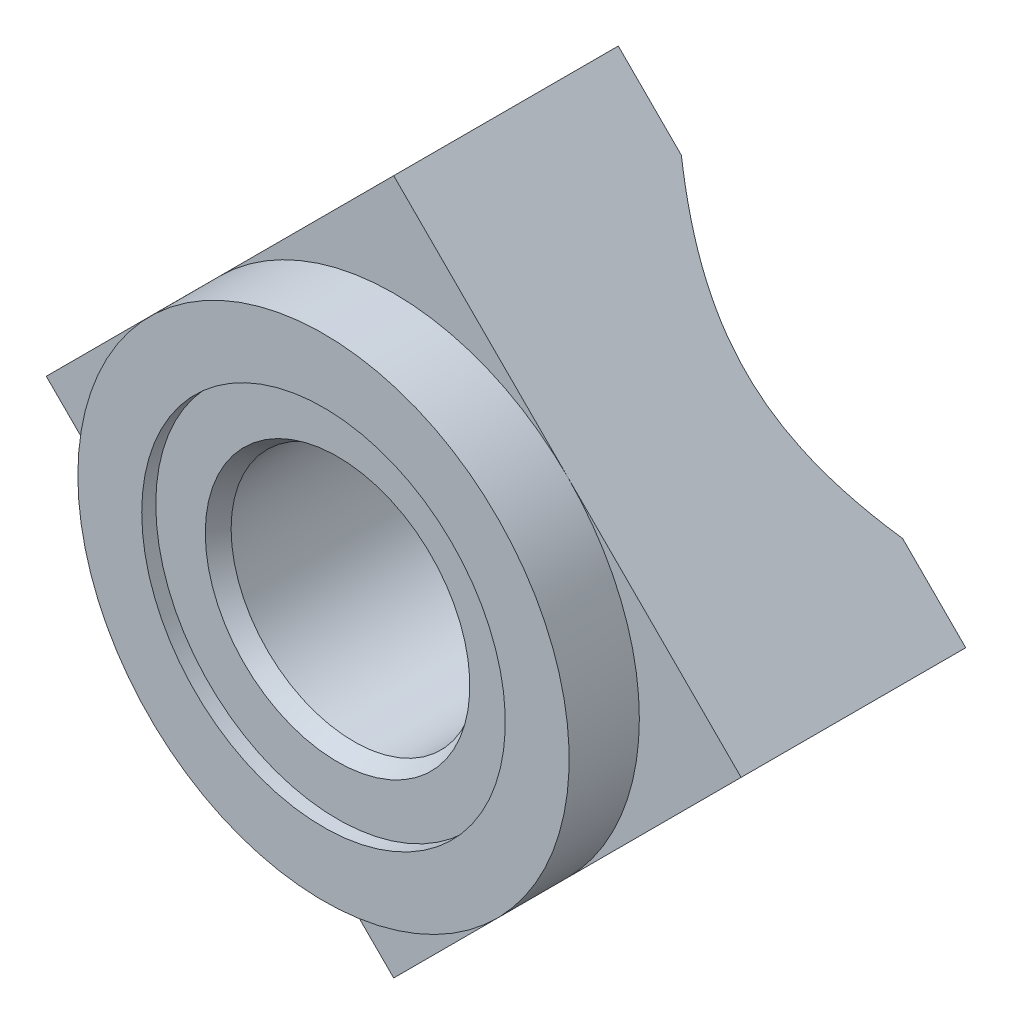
SolidWorks part; units mm, degrees
ref_plane "Front" through (0, 0, 0) normal (0, 0, 1) x (1, 0, 0)
ref_plane "Top" through (0, 0, 0) normal (0, 1, 0) x (1, 0, 0)
ref_plane "Right" through (0, 0, 0) normal (1, 0, 0) x (0, 0, -1)
sketch "Sketch1" plane through (0, 0, 0) normal (0, 0, 1) x (0.7071, 0.7071, 0)
  line L7 (3.5, 3.5) -> (-3.5, 3.5)
  line L8 (-3.5, 3.5) -> (-3.5, -3.5)
  line L9 (-3.5, -3.5) -> (3.5, -3.5)
  line L10 (3.5, -3.5) -> (3.5, 3.5)
  circle A1 centre (0, 0) radius 3.5 construction
  dimension "s" = 7
extrude "BaseNut" add sketch "Sketch1" against normal blind 3.5
sketch "Sketch3" plane through (0, 5.996, -1.0463) normal (-1, 0, 0) x (0, 0, 1)
  line L0 (0.0463, -9.496) -> (0.0463, -10.9458)
  line L2 (0.0463, -9.496) -> (1.0463, -9.496)
  line L3 (-2.4537, -10.9458) -> (1.0463, -10.9458) construction
  line L4 (0, -5.996) -> (7.0423, -5.996) construction
  line L5 (0.0463, -10.9458) -> (1.8463, -10.9458)
  line L6 (1.8463, -10.9458) -> (1.8463, -5.996)
  line L7 (0.8463, -5.996) -> (1.8463, -5.996)
  line L8 (0.8463, -8.586) -> (0.8463, -5.996)
  line L9 (0.8463, -8.586) -> (1.0463, -8.586)
  line L10 (1.0463, -8.586) -> (1.0463, -9.496)
  line L12 (1.0463, -10.9458) -> (1.0463, -5.996) construction
  dimension "D1" = 1
  dimension "s" = 7
  dimension "D2" = 1
  dimension "dd" = 0.2
  dimension "d3" = 5.18
revolve "Bearing-Face" cut sketch "Sketch3" angle 360 about L4
sketch "Sketch4" plane through (0.0573, -0.562, -3.5) normal (0, 0, -1) x (-1, 0, 0)
  circle A0 centre (0.0573, 0.562) radius 1.75
  dimension "D1" = 3.5
extrude "Hole" cut sketch "Sketch4" against normal through all
chamfer "EndChamfer" distance 0.2333 angle 30 2 edges at (-1.75, 0, -3.5) (-1.75, 0, -0.2)
sketch "Sketch8" plane through (0, 0, -3.5) normal (0, 0, -1) x (-1, 0, 0)
  line L0 (-4.9497, 0) -> (0, 4.9497) construction
  line L1 (0, 4.9497) -> (4.9497, 0) construction
  line L2 (4.9497, 0) -> (0, -4.9497) construction
  line L3 (0, -4.9497) -> (-4.9497, 0) construction
  line L4 (-4.9497, 0) -> (0, 4.9497)
  line L5 (0, 4.9497) -> (4.9497, 0)
  line L6 (4.9497, 0) -> (0, -4.9497)
  line L7 (0, -4.9497) -> (-4.9497, 0)
extrude "Extrude1" add sketch "Sketch8" along normal blind 0.7
sketch "Sketch9" plane through (2.5048, 0, 1.645) normal (0, 1, 0) x (0, 0, 1)
  line L0 (-5.145, -2.5048) -> (-5.145, -5.9545)
  line L1 (-5.145, -5.9545) -> (-5.845, -6.6545)
  line L3 (-5.845, -6.6545) -> (-5.845, -2.5048)
  line L4 (-5.845, -2.5048) -> (-5.145, -2.5048)
  line L5 (4.1758, -2.5048) -> (-9.9981, -2.5048) construction
  line L7 (-5.845, -2.5048) -> (-5.845, -7.4545) construction
  dimension "D1" = 45
  dimension "B" = 0.8
revolve "Cut-Revolve1" cut sketch "Sketch9" angle 360 about L5
sketch "Sketch10" plane through (0, 0, 0) normal (0, 1, 0) x (1, 0, 0)
  line L0 (0, 5.447) -> (0, -1.3172) construction
  line L1 (1.5, 3.4903) -> (1.75, 3.4903)
  line L2 (1.75, 3.4903) -> (1.9665, 3.3653)
  line L3 (1.9665, 3.3653) -> (1.75, 3.2403)
  line L4 (1.75, 3.2403) -> (1.5, 3.2403)
  line L5 (1.5, 3.2403) -> (1.5, 3.4903)
  line L6 (-1.75, 3.3653) -> (1.75, 3.3653) construction
  dimension "D1" = 0.25
  dimension "D2" = 3.5
revolve "Cut-Revolve10" [suppressed] cut sketch "Sketch10" angle 360 about L0
pattern_linear "LPattern10" [suppressed] count 10 spacing 0.3 along (0, 0, -1)
equation "\"s@Sketch3\" = \"s@Sketch1\""
equation "\"D1@EndChamfer\" = \"m@BaseNut\" / 15"
equation "\"D2@Sketch10\" = \"D1@Sketch4\""
equation "\"D1@Sketch10\" = (  \"D2@ThreadCosmetic1\" - \"D1@Sketch4\" )  / 2"
equation "\"D3@LPattern10\" = \"D1@Sketch10\" * 1.2"
equation "\"D1@LPattern10\" = \"m@BaseNut\"  / \"D3@LPattern10\" - 2"
